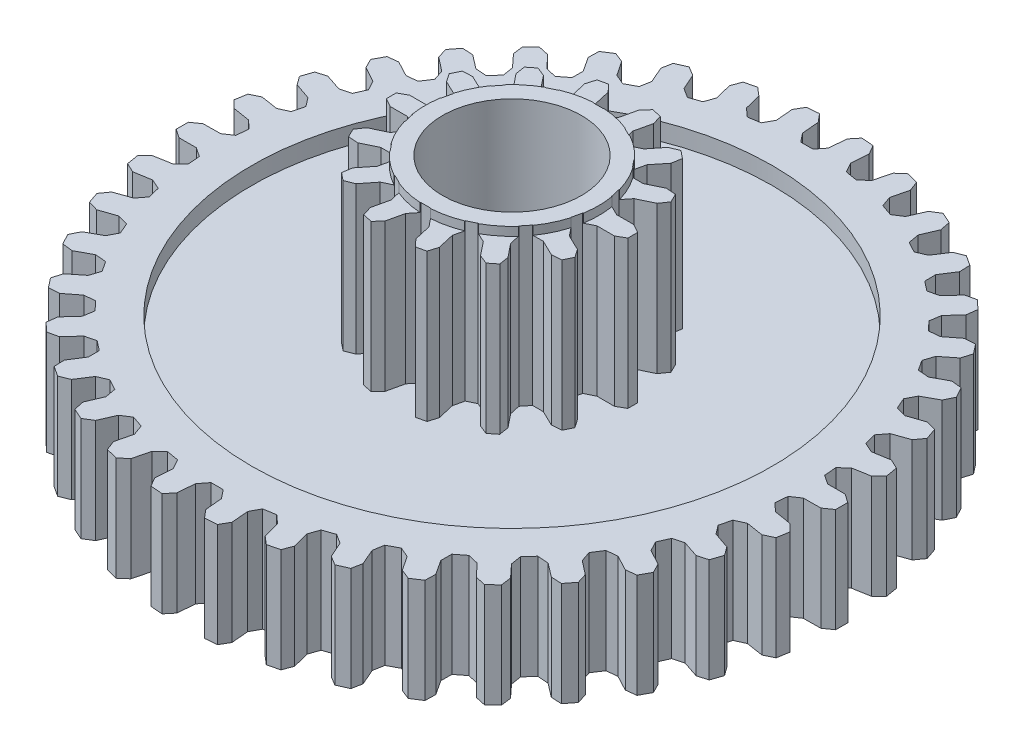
SolidWorks part; units mm, degrees
ref_plane "Front" through (0, 0, 0) normal (0, 0, 1) x (1, 0, 0)
ref_plane "Top" through (0, 0, 0) normal (0, 1, 0) x (1, 0, 0)
ref_plane "Right" through (0, 0, 0) normal (1, 0, 0) x (0, 0, -1)
sketch "Sketch1" plane through (0, 0, 0) normal (0, 0, 1) x (1, 0, 0)
  line L0 (0, 0) -> (0, 7)
  line L1 (0, 0) -> (9.5, 0)
  line L3 (3.5, 3) -> (9.5, 3)
  line L4 (9.5, 0) -> (9.5, 3)
  line L7 (0, 7) -> (3.5, 7)
  line L8 (3.5, 3) -> (3.5, 7)
  dimension "D1" = 3
  dimension "D2" = 6
  dimension "D3" = 4
  dimension "D4" = 3.5
revolve "Revolve1" add sketch "Sketch1" angle 360 about L0
sketch "Sketch2" plane through (0, 3, 0) normal (0, 1, 0) x (-1, 0, 0)
  circle A0 centre (0, 0) radius 3.5
  circle A1 centre (0, 0) radius 7.5
  dimension "D1" = 15
  dimension "D2" = 7
extrude "Cut-Extrude1" cut sketch "Sketch2" against normal blind 0.5
sketch "Sketch3" plane through (0, 3, 0) normal (0, 1, 0) x (-1, 0, 0)
  line L0 (2.1568, 9.2453) -> (1.9273, 9.0458)
  line L1 (1.9273, 9.0458) -> (1.8053, 8.5613)
  line L2 (1.8053, 8.5613) -> (1.5711, 8.348)
  line L3 (1.5711, 8.348) -> (1.2246, 8.4058)
  line L4 (1.2246, 8.4058) -> (1.0699, 8.6838)
  line L5 (1.0699, 8.6838) -> (1.1068, 9.1821)
  line L6 (1.1068, 9.1821) -> (0.9521, 9.4455)
  line L7 (0.9521, 9.4455) -> (0.6057, 9.4742)
  line L8 (0.6057, 9.4742) -> (0.4122, 9.2396)
  line L9 (0.4122, 9.2396) -> (0.3716, 8.7417)
  line L10 (0.3716, 8.7417) -> (0.1756, 8.4927)
  line L11 (0.1756, 8.4927) -> (-0.1756, 8.4927)
  line L12 (-0.1756, 8.4927) -> (-0.3741, 8.7415)
  line L13 (-0.3741, 8.7415) -> (-0.4196, 9.239)
  line L14 (-0.4196, 9.239) -> (-0.6156, 9.4734)
  line L15 (-0.6156, 9.4734) -> (-0.962, 9.4447)
  line L16 (3.6491, 8.7642) -> (3.3899, 8.6052)
  line L17 (3.3899, 8.6052) -> (3.1899, 8.1474)
  line L18 (3.1899, 8.1474) -> (2.9237, 7.9756)
  line L19 (2.9237, 7.9756) -> (2.5915, 8.0896)
  line L20 (2.5915, 8.0896) -> (2.4846, 8.3893)
  line L21 (2.4846, 8.3893) -> (2.603, 8.8747)
  line L22 (2.603, 8.8747) -> (2.4937, 9.16)
  line L23 (2.4937, 9.16) -> (2.1568, 9.2453)
  line L24 (5.0419, 8.0441) -> (4.7601, 7.9298)
  line L25 (4.7601, 7.9298) -> (4.4874, 7.5113)
  line L26 (4.4874, 7.5113) -> (4.1966, 7.3855)
  line L27 (4.1966, 7.3855) -> (3.8876, 7.5527)
  line L28 (3.8876, 7.5527) -> (3.8315, 7.8659)
  line L29 (3.8315, 7.8659) -> (4.0282, 8.3252)
  line L30 (4.0282, 8.3252) -> (3.9674, 8.6246)
  line L31 (3.9674, 8.6246) -> (3.6491, 8.7642)
  line L32 (6.2971, 7.1045) -> (6.0003, 7.0382)
  line L33 (6.0003, 7.0382) -> (5.6625, 6.6702)
  line L34 (5.6625, 6.6702) -> (5.3549, 6.5941)
  line L35 (5.3549, 6.5941) -> (5.0778, 6.8098)
  line L36 (5.0778, 6.8098) -> (5.074, 7.128)
  line L37 (5.074, 7.128) -> (5.3436, 7.5486)
  line L38 (5.3436, 7.5486) -> (5.3329, 7.854)
  line L39 (5.3329, 7.854) -> (5.0419, 8.0441)
  line L40 (7.3806, 5.9711) -> (7.077, 5.9546)
  line L41 (7.077, 5.9546) -> (6.6831, 5.6472)
  line L42 (6.6831, 5.6472) -> (6.3673, 5.6228)
  line L43 (6.3673, 5.6228) -> (6.1294, 5.8812)
  line L44 (6.1294, 5.8812) -> (6.178, 6.1957)
  line L45 (6.178, 6.1957) -> (6.5131, 6.5661)
  line L46 (6.5131, 6.5661) -> (6.5529, 6.8691)
  line L47 (6.5529, 6.8691) -> (6.2971, 7.1045)
  line L48 (8.2628, 4.6749) -> (7.9605, 4.7086)
  line L49 (7.9605, 4.7086) -> (7.5215, 4.4702)
  line L50 (7.5215, 4.4702) -> (7.2059, 4.4981)
  line L51 (7.2059, 4.4981) -> (7.0138, 4.7921)
  line L52 (7.0138, 4.7921) -> (7.1135, 5.0943)
  line L53 (7.1135, 5.0943) -> (7.5051, 5.4046)
  line L54 (7.5051, 5.4046) -> (7.5941, 5.6968)
  line L55 (7.5941, 5.6968) -> (7.3806, 5.9711)
  line L56 (8.9195, 3.2511) -> (8.627, 3.3341)
  line L57 (8.627, 3.3341) -> (8.1547, 3.1712)
  line L58 (8.1547, 3.1712) -> (7.848, 3.2507)
  line L59 (7.848, 3.2507) -> (7.7069, 3.5723)
  line L60 (7.7069, 3.5723) -> (7.855, 3.854)
  line L61 (7.855, 3.854) -> (8.2923, 4.0955)
  line L62 (8.2923, 4.0955) -> (8.4282, 4.3692)
  line L63 (8.4282, 4.3692) -> (8.2628, 4.6749)
  line L64 (9.333, 1.7387) -> (9.0581, 1.8687)
  line L65 (9.0581, 1.8687) -> (8.5654, 1.7858)
  line L66 (8.5654, 1.7858) -> (8.276, 1.9146)
  line L67 (8.276, 1.9146) -> (8.1897, 2.2551)
  line L68 (8.1897, 2.2551) -> (8.3822, 2.5085)
  line L69 (8.3822, 2.5085) -> (8.8533, 2.6748)
  line L70 (8.8533, 2.6748) -> (9.0324, 2.9224)
  line L71 (9.0324, 2.9224) -> (8.9195, 3.2511)
  line L72 (9.4919, 0.1788) -> (9.2421, 0.3523)
  line L73 (9.2421, 0.3523) -> (8.7425, 0.3516)
  line L74 (8.7425, 0.3516) -> (8.4782, 0.5263)
  line L75 (8.4782, 0.5263) -> (8.4492, 0.8764)
  line L76 (8.4492, 0.8764) -> (8.6807, 1.0946)
  line L77 (8.6807, 1.0946) -> (9.1728, 1.1811)
  line L78 (9.1728, 1.1811) -> (9.3902, 1.3958)
  line L79 (9.3902, 1.3958) -> (9.333, 1.7387)
  line L80 (9.3919, -1.386) -> (9.174, -1.1737)
  line L81 (9.174, -1.1737) -> (8.6812, -1.0922)
  line L82 (8.6812, -1.0922) -> (8.4492, -0.8764)
  line L83 (8.4492, -0.8764) -> (8.4782, -0.5263)
  line L84 (8.4782, -0.5263) -> (8.7425, -0.3491)
  line L85 (8.7425, -0.3491) -> (9.2421, -0.3448)
  line L86 (9.2421, -0.3448) -> (9.4919, -0.1688)
  line L87 (9.4919, -0.1688) -> (9.4919, 0.1788)
  line L88 (9.0356, -2.9129) -> (8.8557, -2.6677)
  line L89 (8.8557, -2.6677) -> (8.383, -2.5062)
  line L90 (8.383, -2.5062) -> (8.1897, -2.2551)
  line L91 (8.1897, -2.2551) -> (8.276, -1.9146)
  line L92 (8.276, -1.9146) -> (8.5658, -1.7833)
  line L93 (8.5658, -1.7833) -> (9.0593, -1.8613)
  line L94 (9.0593, -1.8613) -> (9.3346, -1.7288)
  line L95 (9.3346, -1.7288) -> (9.3919, -1.386)
  line L96 (8.433, -4.3604) -> (8.2958, -4.089)
  line L97 (8.2958, -4.089) -> (7.8562, -3.8518)
  line L98 (7.8562, -3.8518) -> (7.7069, -3.5723)
  line L99 (7.7069, -3.5723) -> (7.848, -3.2507)
  line L100 (7.848, -3.2507) -> (8.1555, -3.1689)
  line L101 (8.1555, -3.1689) -> (8.6294, -3.327)
  line L102 (8.6294, -3.327) -> (8.9228, -3.2417)
  line L103 (8.9228, -3.2417) -> (9.0356, -2.9129)
  line L104 (7.6002, -5.6889) -> (7.5097, -5.3986)
  line L105 (7.5097, -5.3986) -> (7.115, -5.0923)
  line L106 (7.115, -5.0923) -> (7.0138, -4.7921)
  line L107 (7.0138, -4.7921) -> (7.2059, -4.4981)
  line L108 (7.2059, -4.4981) -> (7.5227, -4.468)
  line L109 (7.5227, -4.468) -> (7.9641, -4.702)
  line L110 (7.9641, -4.702) -> (8.2675, -4.6661)
  line L111 (8.2675, -4.6661) -> (8.433, -4.3604)
  line L112 (6.5602, -6.8623) -> (6.5187, -6.5611)
  line L113 (6.5187, -6.5611) -> (6.1798, -6.194)
  line L114 (6.1798, -6.194) -> (6.1294, -5.8812)
  line L115 (6.1294, -5.8812) -> (6.3673, -5.6228)
  line L116 (6.3673, -5.6228) -> (6.6847, -5.6453)
  line L117 (6.6847, -5.6453) -> (7.0816, -5.9487)
  line L118 (7.0816, -5.9487) -> (7.3868, -5.9632)
  line L119 (7.3868, -5.9632) -> (7.6002, -5.6889)
  line L120 (5.3412, -7.8485) -> (5.3498, -7.5445)
  line L121 (5.3498, -7.5445) -> (5.0761, -7.1266)
  line L122 (5.0761, -7.1266) -> (5.0778, -6.8098)
  line L123 (5.0778, -6.8098) -> (5.3549, -6.5941)
  line L124 (5.3549, -6.5941) -> (5.6643, -6.6685)
  line L125 (5.6643, -6.6685) -> (6.0059, -7.0331)
  line L126 (6.0059, -7.0331) -> (6.3045, -7.0977)
  line L127 (6.3045, -7.0977) -> (6.5602, -6.8623)
  line L128 (3.9766, -8.6206) -> (4.0351, -8.3222)
  line L129 (4.0351, -8.3222) -> (3.8338, -7.8649)
  line L130 (3.8338, -7.8649) -> (3.8876, -7.5527)
  line L131 (3.8876, -7.5527) -> (4.1966, -7.3855)
  line L132 (4.1966, -7.3855) -> (4.4895, -7.5099)
  line L133 (4.4895, -7.5099) -> (4.7663, -7.9257)
  line L134 (4.7663, -7.9257) -> (5.0503, -8.0386)
  line L135 (5.0503, -8.0386) -> (5.3412, -7.8485)
  line L136 (2.5034, -9.1575) -> (2.6103, -8.8728)
  line L137 (2.6103, -8.8728) -> (2.487, -8.3887)
  line L138 (2.487, -8.3887) -> (2.5915, -8.0896)
  line L139 (2.5915, -8.0896) -> (2.9237, -7.9756)
  line L140 (2.9237, -7.9756) -> (3.1921, -8.1464)
  line L141 (3.1921, -8.1464) -> (3.3968, -8.6022)
  line L142 (3.3968, -8.6022) -> (3.6583, -8.7602)
  line L143 (3.6583, -8.7602) -> (3.9766, -8.6206)
  line L144 (0.962, -9.4447) -> (1.1143, -9.1814)
  line L145 (1.1143, -9.1814) -> (1.0723, -8.6836)
  line L146 (1.0723, -8.6836) -> (1.2246, -8.4058)
  line L147 (1.2246, -8.4058) -> (1.5711, -8.348)
  line L148 (1.5711, -8.348) -> (1.8078, -8.5607)
  line L149 (1.8078, -8.5607) -> (1.9346, -9.0439)
  line L150 (1.9346, -9.0439) -> (2.1665, -9.2429)
  line L151 (2.1665, -9.2429) -> (2.5034, -9.1575)
  line L152 (-0.6057, -9.4742) -> (-0.4122, -9.2396)
  line L153 (-0.4122, -9.2396) -> (-0.3716, -8.7417)
  line L154 (-0.3716, -8.7417) -> (-0.1756, -8.4927)
  line L155 (-0.1756, -8.4927) -> (0.1756, -8.4927)
  line L156 (0.1756, -8.4927) -> (0.3741, -8.7415)
  line L157 (0.3741, -8.7415) -> (0.4196, -9.239)
  line L158 (0.4196, -9.239) -> (0.6156, -9.4734)
  line L159 (0.6156, -9.4734) -> (0.962, -9.4447)
  line L160 (-2.1568, -9.2453) -> (-1.9273, -9.0458)
  line L161 (-1.9273, -9.0458) -> (-1.8053, -8.5613)
  line L162 (-1.8053, -8.5613) -> (-1.5711, -8.348)
  line L163 (-1.5711, -8.348) -> (-1.2246, -8.4058)
  line L164 (-1.2246, -8.4058) -> (-1.0699, -8.6838)
  line L165 (-1.0699, -8.6838) -> (-1.1068, -9.1821)
  line L166 (-1.1068, -9.1821) -> (-0.9521, -9.4455)
  line L167 (-0.9521, -9.4455) -> (-0.6057, -9.4742)
  line L168 (-3.6491, -8.7642) -> (-3.3899, -8.6052)
  line L169 (-3.3899, -8.6052) -> (-3.1899, -8.1474)
  line L170 (-3.1899, -8.1474) -> (-2.9237, -7.9756)
  line L171 (-2.9237, -7.9756) -> (-2.5915, -8.0896)
  line L172 (-2.5915, -8.0896) -> (-2.4846, -8.3893)
  line L173 (-2.4846, -8.3893) -> (-2.603, -8.8747)
  line L174 (-2.603, -8.8747) -> (-2.4937, -9.16)
  line L175 (-2.4937, -9.16) -> (-2.1568, -9.2453)
  line L176 (-5.0419, -8.0441) -> (-4.7601, -7.9298)
  line L177 (-4.7601, -7.9298) -> (-4.4874, -7.5113)
  line L178 (-4.4874, -7.5113) -> (-4.1966, -7.3855)
  line L179 (-4.1966, -7.3855) -> (-3.8876, -7.5527)
  line L180 (-3.8876, -7.5527) -> (-3.8315, -7.8659)
  line L181 (-3.8315, -7.8659) -> (-4.0282, -8.3252)
  line L182 (-4.0282, -8.3252) -> (-3.9674, -8.6246)
  line L183 (-3.9674, -8.6246) -> (-3.6491, -8.7642)
  line L184 (-6.2971, -7.1045) -> (-6.0003, -7.0382)
  line L185 (-6.0003, -7.0382) -> (-5.6625, -6.6702)
  line L186 (-5.6625, -6.6702) -> (-5.3549, -6.5941)
  line L187 (-5.3549, -6.5941) -> (-5.0778, -6.8098)
  line L188 (-5.0778, -6.8098) -> (-5.074, -7.128)
  line L189 (-5.074, -7.128) -> (-5.3436, -7.5486)
  line L190 (-5.3436, -7.5486) -> (-5.3329, -7.854)
  line L191 (-5.3329, -7.854) -> (-5.0419, -8.0441)
  line L192 (-7.3806, -5.9711) -> (-7.077, -5.9546)
  line L193 (-7.077, -5.9546) -> (-6.6831, -5.6472)
  line L194 (-6.6831, -5.6472) -> (-6.3673, -5.6228)
  line L195 (-6.3673, -5.6228) -> (-6.1294, -5.8812)
  line L196 (-6.1294, -5.8812) -> (-6.178, -6.1957)
  line L197 (-6.178, -6.1957) -> (-6.5131, -6.5661)
  line L198 (-6.5131, -6.5661) -> (-6.5529, -6.8691)
  line L199 (-6.5529, -6.8691) -> (-6.2971, -7.1045)
  line L200 (-8.2628, -4.6749) -> (-7.9605, -4.7086)
  line L201 (-7.9605, -4.7086) -> (-7.5215, -4.4702)
  line L202 (-7.5215, -4.4702) -> (-7.2059, -4.4981)
  line L203 (-7.2059, -4.4981) -> (-7.0138, -4.7921)
  line L204 (-7.0138, -4.7921) -> (-7.1135, -5.0943)
  line L205 (-7.1135, -5.0943) -> (-7.5051, -5.4046)
  line L206 (-7.5051, -5.4046) -> (-7.5941, -5.6968)
  line L207 (-7.5941, -5.6968) -> (-7.3806, -5.9711)
  line L208 (-8.9195, -3.2511) -> (-8.627, -3.3341)
  line L209 (-8.627, -3.3341) -> (-8.1547, -3.1712)
  line L210 (-8.1547, -3.1712) -> (-7.848, -3.2507)
  line L211 (-7.848, -3.2507) -> (-7.7069, -3.5723)
  line L212 (-7.7069, -3.5723) -> (-7.855, -3.854)
  line L213 (-7.855, -3.854) -> (-8.2923, -4.0955)
  line L214 (-8.2923, -4.0955) -> (-8.4282, -4.3692)
  line L215 (-8.4282, -4.3692) -> (-8.2628, -4.6749)
  line L216 (-9.333, -1.7387) -> (-9.0581, -1.8687)
  line L217 (-9.0581, -1.8687) -> (-8.5654, -1.7858)
  line L218 (-8.5654, -1.7858) -> (-8.276, -1.9146)
  line L219 (-8.276, -1.9146) -> (-8.1897, -2.2551)
  line L220 (-8.1897, -2.2551) -> (-8.3822, -2.5085)
  line L221 (-8.3822, -2.5085) -> (-8.8533, -2.6748)
  line L222 (-8.8533, -2.6748) -> (-9.0324, -2.9224)
  line L223 (-9.0324, -2.9224) -> (-8.9195, -3.2511)
  line L224 (-9.4919, -0.1788) -> (-9.2421, -0.3523)
  line L225 (-9.2421, -0.3523) -> (-8.7425, -0.3516)
  line L226 (-8.7425, -0.3516) -> (-8.4782, -0.5263)
  line L227 (-8.4782, -0.5263) -> (-8.4492, -0.8764)
  line L228 (-8.4492, -0.8764) -> (-8.6807, -1.0946)
  line L229 (-8.6807, -1.0946) -> (-9.1728, -1.1811)
  line L230 (-9.1728, -1.1811) -> (-9.3902, -1.3958)
  line L231 (-9.3902, -1.3958) -> (-9.333, -1.7387)
  line L232 (-9.3919, 1.386) -> (-9.174, 1.1737)
  line L233 (-9.174, 1.1737) -> (-8.6812, 1.0922)
  line L234 (-8.6812, 1.0922) -> (-8.4492, 0.8764)
  line L235 (-8.4492, 0.8764) -> (-8.4782, 0.5263)
  line L236 (-8.4782, 0.5263) -> (-8.7425, 0.3491)
  line L237 (-8.7425, 0.3491) -> (-9.2421, 0.3448)
  line L238 (-9.2421, 0.3448) -> (-9.4919, 0.1688)
  line L239 (-9.4919, 0.1688) -> (-9.4919, -0.1788)
  line L240 (-9.0356, 2.9129) -> (-8.8557, 2.6677)
  line L241 (-8.8557, 2.6677) -> (-8.383, 2.5062)
  line L242 (-8.383, 2.5062) -> (-8.1897, 2.2551)
  line L243 (-8.1897, 2.2551) -> (-8.276, 1.9146)
  line L244 (-8.276, 1.9146) -> (-8.5658, 1.7833)
  line L245 (-8.5658, 1.7833) -> (-9.0593, 1.8613)
  line L246 (-9.0593, 1.8613) -> (-9.3346, 1.7288)
  line L247 (-9.3346, 1.7288) -> (-9.3919, 1.386)
  line L248 (-8.433, 4.3604) -> (-8.2958, 4.089)
  line L249 (-8.2958, 4.089) -> (-7.8562, 3.8518)
  line L250 (-7.8562, 3.8518) -> (-7.7069, 3.5723)
  line L251 (-7.7069, 3.5723) -> (-7.848, 3.2507)
  line L252 (-7.848, 3.2507) -> (-8.1555, 3.1689)
  line L253 (-8.1555, 3.1689) -> (-8.6294, 3.327)
  line L254 (-8.6294, 3.327) -> (-8.9228, 3.2417)
  line L255 (-8.9228, 3.2417) -> (-9.0356, 2.9129)
  line L256 (-7.6002, 5.6889) -> (-7.5097, 5.3986)
  line L257 (-7.5097, 5.3986) -> (-7.115, 5.0923)
  line L258 (-7.115, 5.0923) -> (-7.0138, 4.7921)
  line L259 (-7.0138, 4.7921) -> (-7.2059, 4.4981)
  line L260 (-7.2059, 4.4981) -> (-7.5227, 4.468)
  line L261 (-7.5227, 4.468) -> (-7.9641, 4.702)
  line L262 (-7.9641, 4.702) -> (-8.2675, 4.6661)
  line L263 (-8.2675, 4.6661) -> (-8.433, 4.3604)
  line L264 (-6.5602, 6.8623) -> (-6.5187, 6.5611)
  line L265 (-6.5187, 6.5611) -> (-6.1798, 6.194)
  line L266 (-6.1798, 6.194) -> (-6.1294, 5.8812)
  line L267 (-6.1294, 5.8812) -> (-6.3673, 5.6228)
  line L268 (-6.3673, 5.6228) -> (-6.6847, 5.6453)
  line L269 (-6.6847, 5.6453) -> (-7.0816, 5.9487)
  line L270 (-7.0816, 5.9487) -> (-7.3868, 5.9632)
  line L271 (-7.3868, 5.9632) -> (-7.6002, 5.6889)
  line L272 (-5.3412, 7.8485) -> (-5.3498, 7.5445)
  line L273 (-5.3498, 7.5445) -> (-5.0761, 7.1266)
  line L274 (-5.0761, 7.1266) -> (-5.0778, 6.8098)
  line L275 (-5.0778, 6.8098) -> (-5.3549, 6.5941)
  line L276 (-5.3549, 6.5941) -> (-5.6643, 6.6685)
  line L277 (-5.6643, 6.6685) -> (-6.0059, 7.0331)
  line L278 (-6.0059, 7.0331) -> (-6.3045, 7.0977)
  line L279 (-6.3045, 7.0977) -> (-6.5602, 6.8623)
  line L280 (-3.9766, 8.6206) -> (-4.0351, 8.3222)
  line L281 (-4.0351, 8.3222) -> (-3.8338, 7.8649)
  line L282 (-3.8338, 7.8649) -> (-3.8876, 7.5527)
  line L283 (-3.8876, 7.5527) -> (-4.1966, 7.3855)
  line L284 (-4.1966, 7.3855) -> (-4.4895, 7.5099)
  line L285 (-4.4895, 7.5099) -> (-4.7663, 7.9257)
  line L286 (-4.7663, 7.9257) -> (-5.0503, 8.0386)
  line L287 (-5.0503, 8.0386) -> (-5.3412, 7.8485)
  line L288 (-2.5034, 9.1575) -> (-2.6103, 8.8728)
  line L289 (-2.6103, 8.8728) -> (-2.487, 8.3887)
  line L290 (-2.487, 8.3887) -> (-2.5915, 8.0896)
  line L291 (-2.5915, 8.0896) -> (-2.9237, 7.9756)
  line L292 (-2.9237, 7.9756) -> (-3.1921, 8.1464)
  line L293 (-3.1921, 8.1464) -> (-3.3968, 8.6022)
  line L294 (-3.3968, 8.6022) -> (-3.6583, 8.7602)
  line L295 (-3.6583, 8.7602) -> (-3.9766, 8.6206)
  line L296 (-0.962, 9.4447) -> (-1.1143, 9.1814)
  line L297 (-1.1143, 9.1814) -> (-1.0723, 8.6836)
  line L298 (-1.0723, 8.6836) -> (-1.2246, 8.4058)
  line L299 (-1.2246, 8.4058) -> (-1.5711, 8.348)
  line L300 (-1.5711, 8.348) -> (-1.8078, 8.5607)
  line L301 (-1.8078, 8.5607) -> (-1.9346, 9.0439)
  line L302 (-1.9346, 9.0439) -> (-2.1665, 9.2429)
  line L303 (-2.1665, 9.2429) -> (-2.5034, 9.1575)
  circle A0 centre (0, 0) radius 9.5
extrude "Cut-Extrude2" cut sketch "Sketch3" against normal through all
sketch "Sketch4" plane through (0, 7, 0) normal (0, 1, 0) x (-1, 0, 0)
  line L0 (0.6365, 3.4222) -> (0.9113, 3.3594)
  line L1 (0.9113, 3.3594) -> (0.993, 3.086)
  line L2 (0.993, 3.086) -> (0.8815, 2.6018)
  line L3 (0.8815, 2.6018) -> (0.9518, 2.299)
  line L4 (0.9518, 2.299) -> (1.204, 2.1775)
  line L5 (1.204, 2.1775) -> (1.4846, 2.3113)
  line L6 (1.4846, 2.3113) -> (1.7936, 2.7004)
  line L7 (1.7936, 2.7004) -> (2.0583, 2.8071)
  line L8 (-0.9113, 3.3594) -> (-0.6365, 3.4222)
  line L9 (-0.6365, 3.4222) -> (-0.4443, 3.2112)
  line L10 (-0.4443, 3.2112) -> (-0.3347, 2.7266)
  line L11 (-0.3347, 2.7266) -> (-0.14, 2.4843)
  line L12 (-0.14, 2.4843) -> (0.14, 2.4843)
  line L13 (0.14, 2.4843) -> (0.3347, 2.7266)
  line L14 (0.3347, 2.7266) -> (0.4443, 3.2112)
  line L15 (0.4443, 3.2112) -> (0.6365, 3.4222)
  line L16 (2.0583, 2.8071) -> (2.2787, 2.6313)
  line L17 (2.2787, 2.6313) -> (2.2336, 2.3495)
  line L18 (2.2336, 2.3495) -> (1.923, 1.9617)
  line L19 (1.923, 1.9617) -> (1.855, 1.6583)
  line L20 (1.855, 1.6583) -> (2.0295, 1.4395)
  line L21 (2.0295, 1.4395) -> (2.3404, 1.4383)
  line L22 (2.3404, 1.4383) -> (2.7876, 1.6548)
  line L23 (2.7876, 1.6548) -> (3.0724, 1.636)
  line L24 (3.0724, 1.636) -> (3.1947, 1.3821)
  line L25 (3.1947, 1.3821) -> (3.0318, 1.1477)
  line L26 (3.0318, 1.1477) -> (2.5837, 0.933)
  line L27 (2.5837, 0.933) -> (2.3909, 0.6893)
  line L28 (2.3909, 0.6893) -> (2.4531, 0.4164)
  line L29 (2.4531, 0.4164) -> (2.7327, 0.2804)
  line L30 (2.7327, 0.2804) -> (3.2296, 0.2814)
  line L31 (3.2296, 0.2814) -> (3.478, 0.1409)
  line L32 (3.478, 0.1409) -> (3.478, -0.1409)
  line L33 (3.478, -0.1409) -> (3.2296, -0.2814)
  line L34 (3.2296, -0.2814) -> (2.7327, -0.2804)
  line L35 (2.7327, -0.2804) -> (2.4531, -0.4164)
  line L36 (2.4531, -0.4164) -> (2.3909, -0.6893)
  line L37 (2.3909, -0.6893) -> (2.5837, -0.933)
  line L38 (2.5837, -0.933) -> (3.0318, -1.1477)
  line L39 (3.0318, -1.1477) -> (3.1947, -1.3821)
  line L40 (3.1947, -1.3821) -> (3.0724, -1.636)
  line L41 (3.0724, -1.636) -> (2.7876, -1.6548)
  line L42 (2.7876, -1.6548) -> (2.3404, -1.4383)
  line L43 (2.3404, -1.4383) -> (2.0295, -1.4395)
  line L44 (2.0295, -1.4395) -> (1.855, -1.6583)
  line L45 (1.855, -1.6583) -> (1.923, -1.9617)
  line L46 (1.923, -1.9617) -> (2.2336, -2.3495)
  line L47 (2.2336, -2.3495) -> (2.2787, -2.6313)
  line L48 (2.2787, -2.6313) -> (2.0583, -2.8071)
  line L49 (2.0583, -2.8071) -> (1.7936, -2.7004)
  line L50 (1.7936, -2.7004) -> (1.4846, -2.3113)
  line L51 (1.4846, -2.3113) -> (1.204, -2.1775)
  line L52 (1.204, -2.1775) -> (0.9518, -2.299)
  line L53 (0.9518, -2.299) -> (0.8815, -2.6018)
  line L54 (0.8815, -2.6018) -> (0.993, -3.086)
  line L55 (0.993, -3.086) -> (0.9113, -3.3594)
  line L56 (0.9113, -3.3594) -> (0.6365, -3.4222)
  line L57 (0.6365, -3.4222) -> (0.4443, -3.2112)
  line L58 (0.4443, -3.2112) -> (0.3347, -2.7266)
  line L59 (0.3347, -2.7266) -> (0.14, -2.4843)
  line L60 (0.14, -2.4843) -> (-0.14, -2.4843)
  line L61 (-0.14, -2.4843) -> (-0.3347, -2.7266)
  line L62 (-0.3347, -2.7266) -> (-0.4443, -3.2112)
  line L63 (-0.4443, -3.2112) -> (-0.6365, -3.4222)
  line L64 (-0.6365, -3.4222) -> (-0.9113, -3.3594)
  line L65 (-0.9113, -3.3594) -> (-0.993, -3.086)
  line L66 (-0.993, -3.086) -> (-0.8815, -2.6018)
  line L67 (-0.8815, -2.6018) -> (-0.9518, -2.299)
  line L68 (-0.9518, -2.299) -> (-1.204, -2.1775)
  line L69 (-1.204, -2.1775) -> (-1.4846, -2.3113)
  line L70 (-1.4846, -2.3113) -> (-1.7936, -2.7004)
  line L71 (-1.7936, -2.7004) -> (-2.0583, -2.8071)
  line L72 (-2.0583, -2.8071) -> (-2.2787, -2.6313)
  line L73 (-2.2787, -2.6313) -> (-2.2336, -2.3495)
  line L74 (-2.2336, -2.3495) -> (-1.923, -1.9617)
  line L75 (-1.923, -1.9617) -> (-1.855, -1.6583)
  line L76 (-1.855, -1.6583) -> (-2.0295, -1.4395)
  line L77 (-2.0295, -1.4395) -> (-2.3404, -1.4383)
  line L78 (-2.3404, -1.4383) -> (-2.7876, -1.6548)
  line L79 (-2.7876, -1.6548) -> (-3.0724, -1.636)
  line L80 (-3.0724, -1.636) -> (-3.1947, -1.3821)
  line L81 (-3.1947, -1.3821) -> (-3.0318, -1.1477)
  line L82 (-3.0318, -1.1477) -> (-2.5837, -0.933)
  line L83 (-2.5837, -0.933) -> (-2.3909, -0.6893)
  line L84 (-2.3909, -0.6893) -> (-2.4531, -0.4164)
  line L85 (-2.4531, -0.4164) -> (-2.7327, -0.2804)
  line L86 (-2.7327, -0.2804) -> (-3.2296, -0.2814)
  line L87 (-3.2296, -0.2814) -> (-3.478, -0.1409)
  line L88 (-3.478, -0.1409) -> (-3.478, 0.1409)
  line L89 (-3.478, 0.1409) -> (-3.2296, 0.2814)
  line L90 (-3.2296, 0.2814) -> (-2.7327, 0.2804)
  line L91 (-2.7327, 0.2804) -> (-2.4531, 0.4164)
  line L92 (-2.4531, 0.4164) -> (-2.3909, 0.6893)
  line L93 (-2.3909, 0.6893) -> (-2.5837, 0.933)
  line L94 (-2.5837, 0.933) -> (-3.0318, 1.1477)
  line L95 (-3.0318, 1.1477) -> (-3.1947, 1.3821)
  line L96 (-3.1947, 1.3821) -> (-3.0724, 1.636)
  line L97 (-3.0724, 1.636) -> (-2.7876, 1.6548)
  line L98 (-2.7876, 1.6548) -> (-2.3404, 1.4383)
  line L99 (-2.3404, 1.4383) -> (-2.0295, 1.4395)
  line L100 (-2.0295, 1.4395) -> (-1.855, 1.6583)
  line L101 (-1.855, 1.6583) -> (-1.923, 1.9617)
  line L102 (-1.923, 1.9617) -> (-2.2336, 2.3495)
  line L103 (-2.2336, 2.3495) -> (-2.2787, 2.6313)
  line L104 (-2.2787, 2.6313) -> (-2.0583, 2.8071)
  line L105 (-2.0583, 2.8071) -> (-1.7936, 2.7004)
  line L106 (-1.7936, 2.7004) -> (-1.4846, 2.3113)
  line L107 (-1.4846, 2.3113) -> (-1.204, 2.1775)
  line L108 (-1.204, 2.1775) -> (-0.9518, 2.299)
  line L109 (-0.9518, 2.299) -> (-0.8815, 2.6018)
  line L110 (-0.8815, 2.6018) -> (-0.993, 3.086)
  line L111 (-0.993, 3.086) -> (-0.9113, 3.3594)
  circle A0 centre (0, 0) radius 3.5
extrude "Cut-Extrude3" cut sketch "Sketch4" against normal blind 4.5
sketch "Sketch5" plane through (0, 7, 0) normal (0, 1, 0) x (-1, 0, 0)
  circle A0 centre (0, 0) radius 3.5
  circle A1 centre (0, 0) radius 2.5
extrude "Cut-Extrude4" cut sketch "Sketch5" against normal blind 0.25
sketch "Sketch6" plane through (0, 7, 0) normal (0, 1, 0) x (-1, 0, 0)
  circle A0 centre (0, 0) radius 2
extrude "Cut-Extrude5" cut sketch "Sketch6" against normal through all
